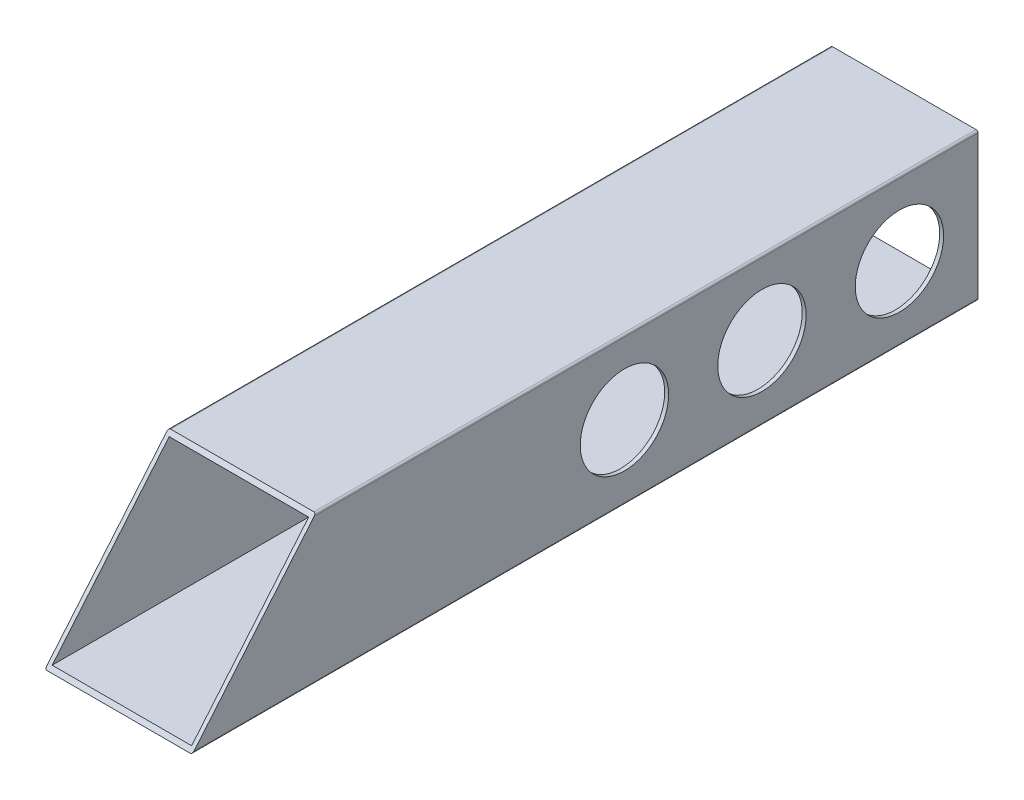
SolidWorks part; units mm, degrees
ref_plane "Plan de face" through (0, 0, 0) normal (0, 0, 1) x (1, 0, 0)
ref_plane "Plan de dessus" through (0, 0, 0) normal (0, 1, 0) x (1, 0, 0)
ref_plane "Plan de droite" through (0, 0, 0) normal (1, 0, 0) x (0, 0, -1)
sketch "Esquisse1" plane through (0, 0, 0) normal (0, 0, 1) x (1, 0, 0)
  line L0 (0, 2) -> (0, 148)
  line L1 (2, 150) -> (148, 150)
  line L2 (150, 148) -> (150, 2)
  line L3 (148, 0) -> (2, 0)
  line L4 (4, 146) -> (146, 146)
  line L5 (146, 146) -> (146, 4)
  line L6 (146, 4) -> (4, 4)
  line L7 (4, 4) -> (4, 146)
  arc A0 (150, 2) -> (148, 0) centre (148, 2) cw
  arc A1 (0, 2) -> (2, 0) centre (2, 2) ccw
  arc A2 (148, 150) -> (150, 148) centre (148, 148) cw
  arc A3 (0, 148) -> (2, 150) centre (2, 148) cw
  arc A4 (146, 146) -> (146, 146) centre (146, 146) cw
  arc A5 (146, 4) -> (146, 4) centre (146, 4) cw
  arc A6 (4, 4) -> (4, 4) centre (4, 4) ccw
  arc A7 (4, 146) -> (4, 146) centre (4, 146) cw
  point P7 (150, 0)
  point P10 (0, 0)
  point P13 (150, 150)
  dimension "D3" = 2
  dimension "D1" = 150
  dimension "D2" = 150
  dimension "D4" = 4
extrude "Boss.-Extru.1" add sketch "Esquisse1" along normal blind 800
sketch "Esquisse2" plane through (150, 0, 0) normal (1, 0, 0) x (0, 0, -1)
  line L0 (-800, 0) -> (-674.1351, 150)
  line L1 (-674.1351, 150) -> (-800, 150)
  line L2 (-800, 150) -> (-800, 0)
  line L3 (0, 75) -> (-491.3237, 75) construction
  line L4 (0, 2) -> (0, 148) construction
  circle A0 centre (-80, 75) radius 45
  circle A1 centre (-220, 75) radius 45
  circle A2 centre (-360, 75) radius 45
  dimension "D2" = 140
  dimension "D3" = 140
  dimension "D4" = 90
  dimension "D1" = 80
  dimension "D5" = 40
extrude "Enlèv. mat.-Extru.1" cut sketch "Esquisse2" against normal through all
